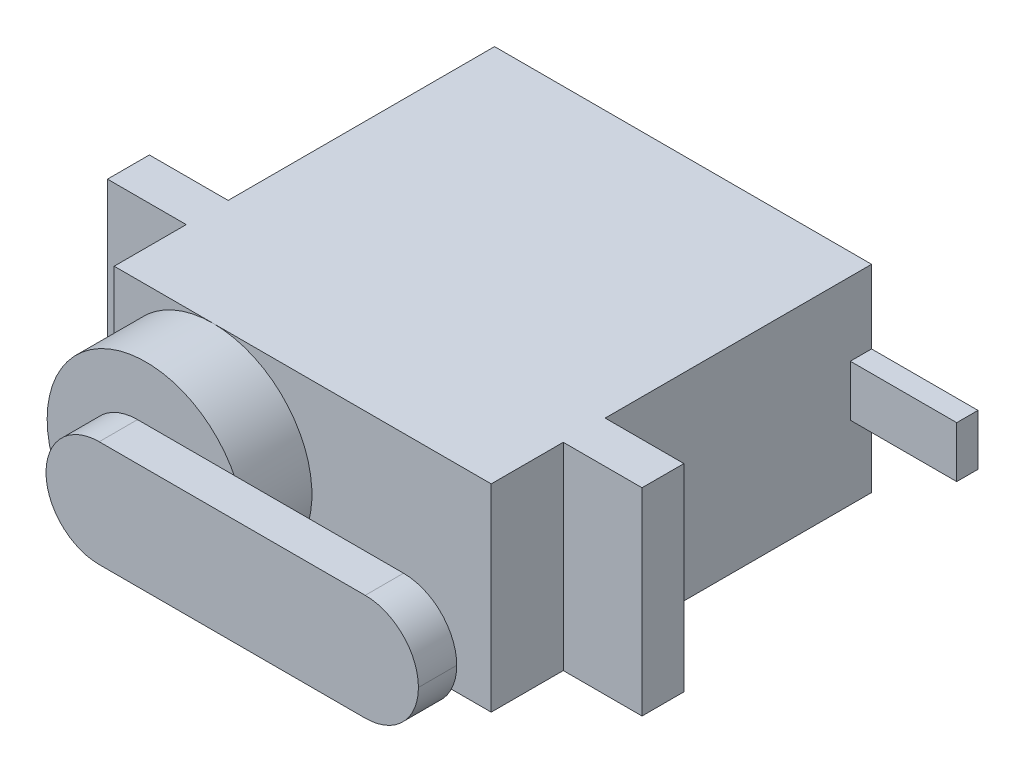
SolidWorks part; units mm, degrees
ref_plane "Front Plane" through (0, 0, 0) normal (0, 0, 1) x (1, 0, 0)
ref_plane "Top Plane" through (0, 0, 0) normal (0, 1, 0) x (1, 0, 0)
ref_plane "Right Plane" through (0, 0, 0) normal (1, 0, 0) x (0, 0, -1)
sketch "Sketch2" plane through (0, 0, 0) normal (0, 0, 1) x (1, 0, 0)
  line L1 (-11.25, 5.9) -> (11.25, 5.9)
  line L2 (-11.25, 5.9) -> (-11.25, -5.9)
  line L3 (-11.25, -5.9) -> (11.25, -5.9)
  line L4 (11.25, 5.9) -> (11.25, -5.9)
  line L5 (-11.25, 5.9) -> (11.25, -5.9) construction
  line L6 (-11.25, -5.9) -> (11.25, 5.9) construction
  point P0 (0, 0)
  dimension "D1" = 11.8
  dimension "D2" = 22.5
extrude "Boss-Extrude1" add sketch "Sketch2" along normal blind 15.9
sketch "Sketch3" plane through (0, 0, 15.9) normal (0, 0, 1) x (1, 0, 0)
  line L0 (-11.25, 5.9) -> (-11.25, -5.9) construction
  line L1 (-15.95, -5.9) -> (15.95, -5.9)
  line L2 (-15.95, -5.9) -> (-15.95, 5.9)
  line L3 (-15.95, 5.9) -> (15.95, 5.9)
  line L4 (15.95, -5.9) -> (15.95, 5.9)
  line L5 (11.25, -5.9) -> (11.25, 5.9) construction
  dimension "D1" = 4.7
  dimension "D2" = 4.7
extrude "Boss-Extrude2" add sketch "Sketch3" along normal blind 2.5
sketch "Sketch4" plane through (0, 0, 18.4) normal (0, 0, 1) x (1, 0, 0)
  line L0 (-15.95, -5.9) -> (15.95, -5.9) construction
  line L1 (-11.25, -5.9) -> (11.25, -5.9)
  line L2 (-11.25, -5.9) -> (-11.25, 5.9)
  line L3 (-11.25, 5.9) -> (11.25, 5.9)
  line L4 (11.25, -5.9) -> (11.25, 5.9)
  line L5 (15.95, 5.9) -> (-15.95, 5.9) construction
  line L6 (-15.95, 5.9) -> (-15.95, -5.9) construction
  point P8 (-11.25, 0)
  dimension "D1" = 22.5
  dimension "D2" = 4.7
extrude "Boss-Extrude3" add sketch "Sketch4" along normal blind 4.3
sketch "Sketch5" plane through (0, 0, 22.7) normal (0, 0, 1) x (1, 0, 0)
  line L0 (-11.25, 5.9) -> (-11.25, -5.9) construction
  circle A0 centre (-5.35, 0) radius 5.9
  dimension "D1" = 5.9
extrude "Boss-Extrude4" add sketch "Sketch5" along normal blind 4
sketch "Sketch6" plane through (0, 0, 26.7) normal (0, 0, 1) x (1, 0, 0)
  circle A0 centre (-5.35, 0) radius 2.3
  dimension "D1" = 4.6
extrude "Boss-Extrude5" add sketch "Sketch6" along normal blind 0.508
sketch "Sketch7" plane through (0, 0, 27.208) normal (0, 0, 1) x (1, 0, 0)
  line L1 (-5.35, 3.175) -> (13.7, 3.175)
  line L3 (-5.35, -3.175) -> (13.7, -3.175)
  line L4 (13.7, 3.175) -> (13.7, -3.175)
  arc A0 (-5.35, 3.175) -> (-5.35, -3.175) centre (-5.35, 0) ccw
  point P0 (-5.35, 0)
  dimension "D2" = 6.35
extrude "Boss-Extrude6" add sketch "Sketch7" along normal blind 2.286
fillet "Fillet1" radius 3.175 2 edges at (13.7, 3.175, 28.351) (13.7, -3.175, 28.351)
sketch "Sketch8" plane through (11.25, 0, 0) normal (1, 0, 0) x (0, 0, -1)
  line L0 (0, 1.524) -> (0, -1.524)
  line L1 (-1.27, 1.524) -> (0, 1.524)
  line L2 (-1.27, 1.524) -> (-1.27, -1.524)
  line L3 (-1.27, -1.524) -> (0, -1.524)
  line L5 (-1.27, 1.524) -> (0, 0) construction
  line L6 (-1.27, -1.524) -> (0, 0) construction
  point P0 (0, 0)
  dimension "D1" = 3.048
  dimension "D2" = 1.524
extrude "Boss-Extrude7" add sketch "Sketch8" along normal blind 6.35
